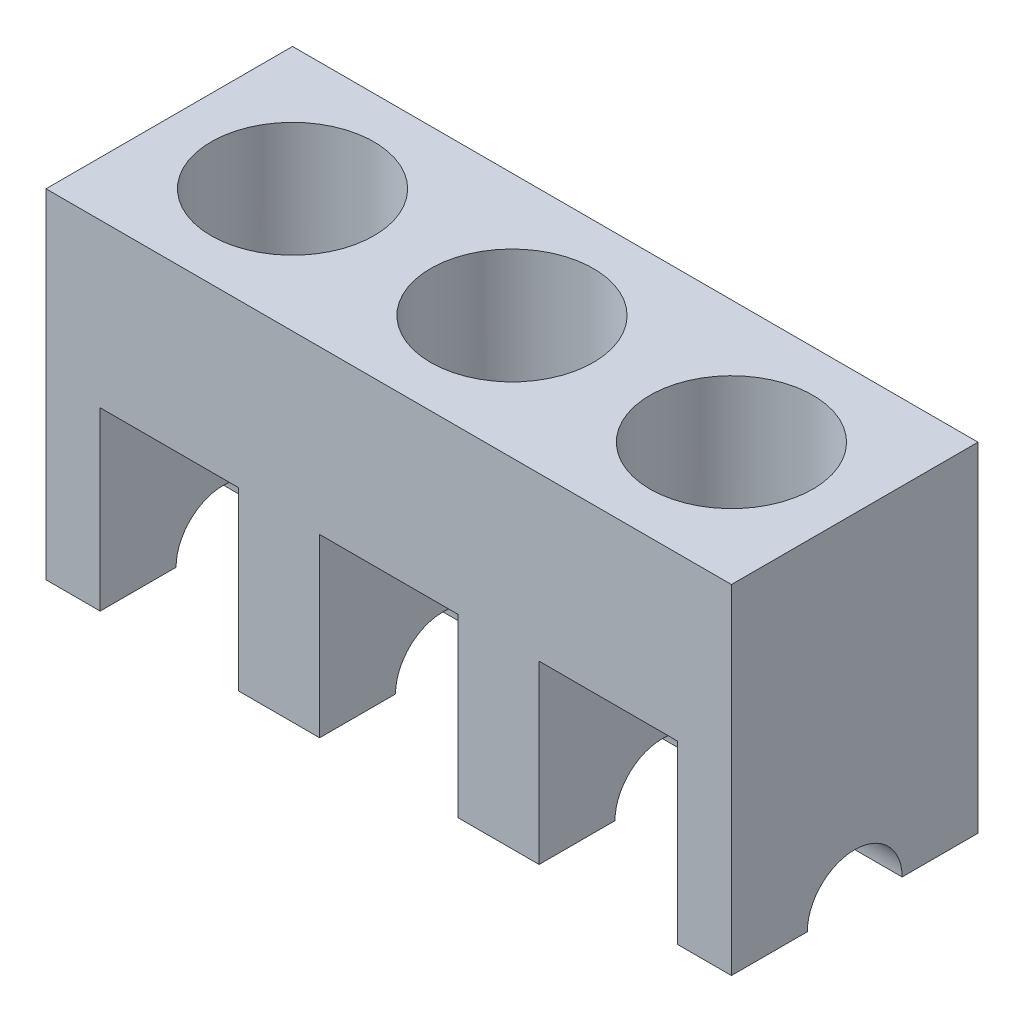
SolidWorks part; units mm, degrees
ref_plane "Front Plane" through (0, 0, 0) normal (0, 0, 1) x (1, 0, 0)
ref_plane "Top Plane" through (0, 0, 0) normal (0, 1, 0) x (1, 0, 0)
ref_plane "Right Plane" through (0, 0, 0) normal (1, 0, 0) x (0, 0, -1)
sketch "Sketch1" plane through (0, 0, 0) normal (0, 0, 1) x (1, 0, 0)
  line L1 (0, 0) -> (253, 0)
  line L2 (0, 0) -> (0, 125)
  line L3 (0, 125) -> (253, 125)
  line L4 (253, 0) -> (253, 125)
  dimension "D1" = 253
  dimension "D2" = 125
extrude "Boss-Extrude1" add sketch "Sketch1" along normal mid plane 91
sketch "Sketch2" plane through (0, 0, 45.5) normal (0, 0, 1) x (1, 0, 0)
  line L0 (0, 0) -> (20, 0) construction
  line L1 (0, 0) -> (253, 0) construction
  line L2 (20, 0) -> (20, 65)
  line L3 (20, 65) -> (71, 65)
  line L4 (71, 65) -> (71, 0)
  line L5 (71, 0) -> (101, 0)
  line L6 (101, 0) -> (101, 65)
  line L7 (101, 65) -> (152, 65)
  line L8 (152, 65) -> (152, 0)
  line L9 (152, 0) -> (182, 0)
  line L10 (182, 0) -> (182, 65)
  line L11 (182, 65) -> (233, 65)
  line L12 (233, 65) -> (233, 0)
  line L13 (233, 0) -> (253, 0)
  line L14 (20, 0) -> (71, 0)
  line L15 (101, 0) -> (152, 0)
  line L16 (101, 0) -> (152, 0)
  line L17 (233, 0) -> (182, 0)
  dimension "D1" = 20
  dimension "D2" = 20
  dimension "D3" = 65
  dimension "D4" = 30
  dimension "D5" = 51
extrude "Cut-Extrude2" cut sketch "Sketch2" against normal blind 91 contours L4 L3 L2 M15 | L8 L7 L6 M15 | L12 L11 L10 M15
sketch "Sketch3" plane through (0, 125, 0) normal (0, 1, 0) x (1, 0, 0)
  line L0 (0, -45.5) -> (0, 45.5) construction
  circle A0 centre (45.5, 0) radius 30.05
  circle A1 centre (126.5, 0) radius 30.05
  circle A2 centre (207.5, 0) radius 30.05
  point P9 (0, 0)
  dimension "D1" = 60.1
  dimension "D2" = 45.5
  dimension "D3" = 81
  dimension "D4" = 81
extrude "Cut-Extrude3" cut sketch "Sketch3" against normal blind 81
sketch "Sketch4" plane through (253, 0, 0) normal (1, 0, 0) x (0, 0, -1)
  line L0 (-45.5, 0) -> (45.5, 0) construction
  line L1 (-17.5, 0) -> (17.5, 0)
  arc A0 (17.5, 0) -> (-17.5, 0) centre (0, 0) ccw
  dimension "D1" = 17.5
extrude "Cut-Extrude4" cut sketch "Sketch4" against normal through all
